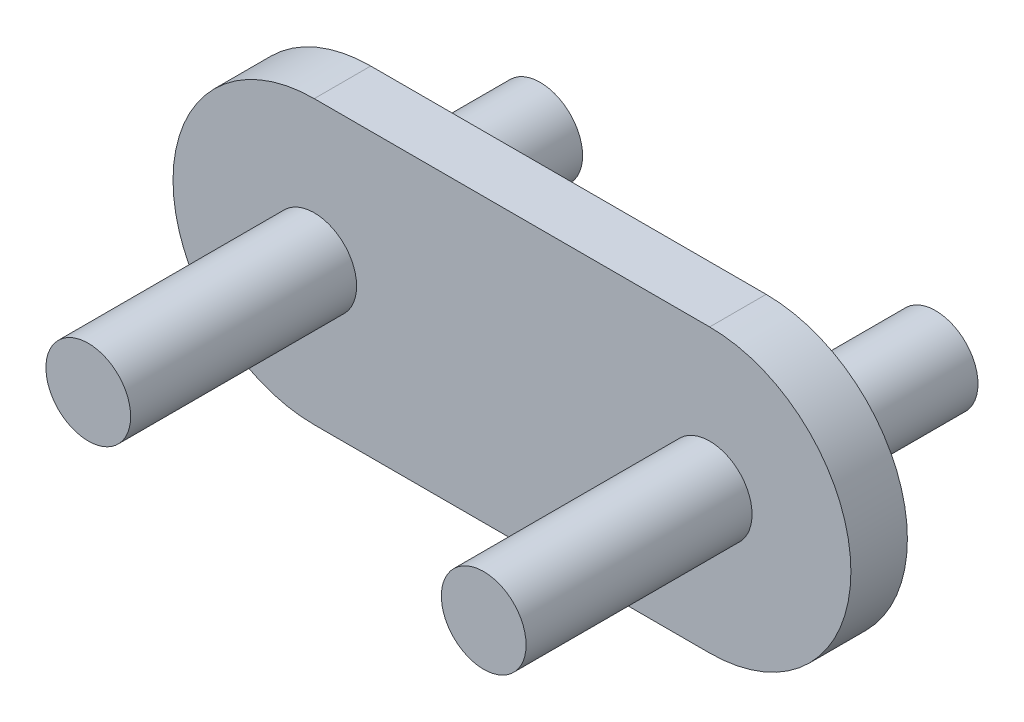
SolidWorks part; units mm, degrees
ref_plane "Front Plane" through (0, 0, 0) normal (0, 0, 1) x (1, 0, 0)
ref_plane "Top Plane" through (0, 0, 0) normal (0, 1, 0) x (1, 0, 0)
ref_plane "Right Plane" through (0, 0, 0) normal (1, 0, 0) x (0, 0, -1)
sketch "Sketch1" plane through (0, 0, 0) normal (0, 0, 1) x (1, 0, 0)
  line L0 (0, 25) -> (-70, 25)
  line L1 (-70, -25) -> (0, -25)
  arc A0 (-70, 25) -> (-70, -25) centre (-70, 0) ccw
  arc A1 (0, -25) -> (0, 25) centre (0, 0) ccw
  circle A2 centre (-70, 0) radius 7.5
  circle A4 centre (0, 0) radius 7.5
  dimension "D1" = 25
  dimension "D2" = 70
  dimension "D7" = 15
extrude "Extrude1" add sketch "Sketch1" along normal blind 10
sketch "Sketch3" plane through (0, 0, 10) normal (0, 0, 1) x (1, 0, 0)
  circle A0 centre (0, 0) radius 7.5 construction
  circle A1 centre (0, 0) radius 7.5
  circle A2 centre (-70, 0) radius 7.5 construction
  circle A3 centre (-70, 0) radius 7.5
extrude "Extrude2" add sketch "Sketch3" along normal mid plane 80
